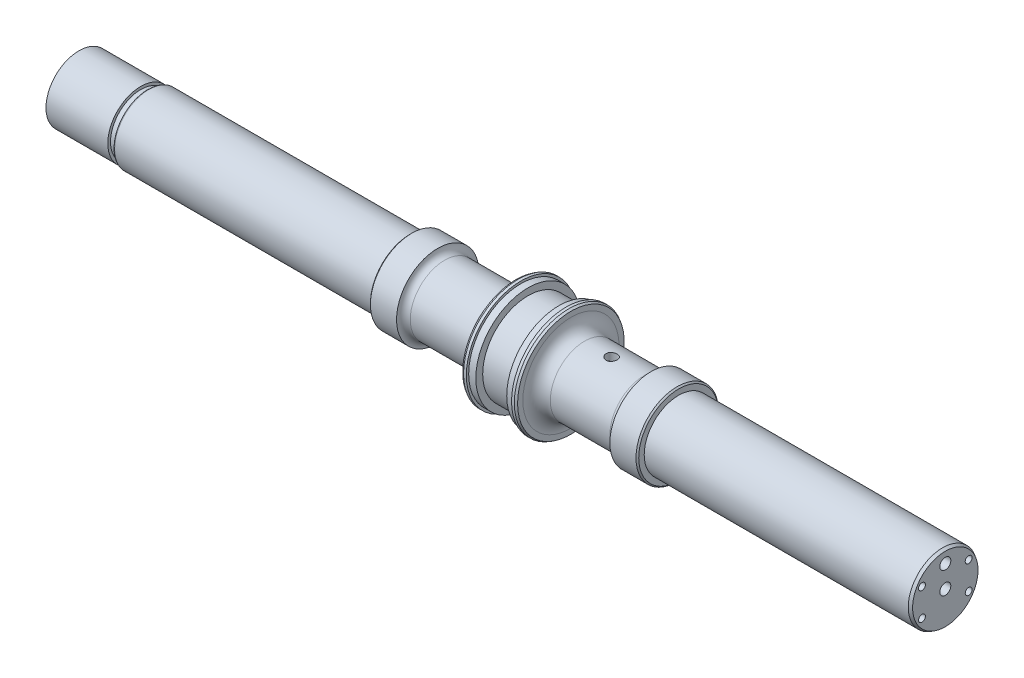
SolidWorks part; units mm, degrees
ref_plane "Plan de face" through (0, 0, 0) normal (0, 0, 1) x (1, 0, 0)
ref_plane "Plan de dessus" through (0, 0, 0) normal (0, 1, 0) x (1, 0, 0)
ref_plane "Plan de droite" through (0, 0, 0) normal (1, 0, 0) x (0, 0, -1)
sketch "Esquisse1" plane through (0, 0, 0) normal (0, 0, 1) x (1, 0, 0)
  line L0 (0, 0) -> (685.6091, 0) construction
  line L1 (0, 0) -> (0, 24)
  line L2 (0, 24) -> (45, 24)
  line L3 (45, 24) -> (45, 22)
  line L4 (45, 22) -> (50, 22)
  line L5 (50, 22) -> (50, 25)
  line L6 (50, 25) -> (241.3, 25)
  line L7 (241.3, 25) -> (241.3, 30)
  line L8 (241.3, 30) -> (261.3, 30)
  line L9 (261.3, 30) -> (261.3, 25)
  line L10 (261.3, 25) -> (318.3, 25)
  line L11 (318.3, 25) -> (318.3, 39.7)
  line L12 (318.3, 39.7) -> (321.85, 39.7)
  line L13 (321.85, 39.7) -> (321.85, 38)
  line L14 (321.85, 38) -> (327.05, 38)
  line L15 (327.05, 38) -> (327.05, 33)
  line L16 (327.05, 33) -> (349.55, 33)
  line L17 (349.55, 33) -> (349.55, 38)
  line L18 (349.55, 38) -> (354.75, 38)
  line L19 (354.75, 38) -> (354.75, 39.7)
  line L20 (354.75, 39.7) -> (358.3, 39.7)
  line L21 (358.3, 39.7) -> (358.3, 25)
  line L22 (358.3, 25) -> (416.7, 25)
  line L23 (416.7, 25) -> (416.7, 30)
  line L24 (416.7, 30) -> (436.7, 30)
  line L25 (436.7, 30) -> (436.7, 25)
  line L26 (436.7, 25) -> (631, 25)
  line L27 (631, 25) -> (631, 4)
  line L28 (0, 0) -> (293.5966, 0)
  line L29 (631, 4) -> (296, 4)
  line L30 (296, 4) -> (293.5966, 0)
  dimension "D1" = 48
  dimension "D2" = 45
  dimension "D3" = 44
  dimension "D4" = 50
  dimension "D5" = 50
  dimension "D6" = 241.3
  dimension "D7" = 60
  dimension "D8" = 20
  dimension "D9" = 50
  dimension "D10" = 318.3
  dimension "D11" = 66
  dimension "D12" = 79.4
  dimension "D13" = 5.2
  dimension "D14" = 8.75
  dimension "D15" = 76
  dimension "D16" = 40
  dimension "D17" = 79.4
  dimension "D18" = 22.5
  dimension "D19" = 76
  dimension "D20" = 3.55
  dimension "D21" = 50
  dimension "D22" = 60
  dimension "D23" = 416.7
  dimension "D24" = 20
  dimension "D25" = 50
  dimension "D26" = 631
  dimension "D27" = 59
  dimension "D28" = 335
  dimension "D29" = 8
revolve "Révolution1" add sketch "Esquisse1" angle 360 about L0
fillet "Congé1" radius 10 2 edges at (318.3, 0, 25) (358.3, 0, 25)
fillet "Congé2" radius 5 2 edges at (416.7, 0, 25) (261.3, 0, 25)
chamfer "Chanfrein1" distance 1 angle 45 2 edges at (436.7, 0, 30) (241.3, 0, 30)
fillet "Congé3" radius 1 1 edges at (50, 0, 25)
chamfer "Chanfrein3" distance 2 angle 30 1 edges at (631, 0, 25)
chamfer "Chanfrein4" distance 1.5 angle 30 2 edges at (358.3, 0, 39.7) (318.3, 0, 39.7)
sketch "Esquisse4" plane through (631, 0, 0) normal (1, 0, 0) x (0, 0, -1)
  line L0 (0, -15.7061) -> (0, 48.4912) construction
  point P3 (0, 16)
  dimension "D1" = 16
hole_wizard "Dégagement M81" positions "Esquisse3D1" profile "Esquisse6" hole size "M8" standard "ISO"
sketch3d "Esquisse3D1"
  point P0 (631, 16, 0)
sketch "Esquisse6" plane through (631, 16, 0) normal (0, 1, 0) x (0, 0, -1)
  line L0 (0, 0) -> (0, 253.4034)
  line L1 (0, 253.4034) -> (4, 251)
  line L2 (4, 251) -> (4, 0)
  line L5 (4, 0) -> (0, 0)
  line L10 (0, 253.4034) -> (-4, 251) construction
  line L11 (0, -6.35) -> (0, 107.95) construction
  dimension "Diamètre du perçage" = 8
  dimension "Profondeur du perçage" = 251
  dimension "Angle de pointe" = 118
sketch "Esquisse7" plane through (631, 0, 0) normal (1, 0, 0) x (0, 0, -1)
  line L0 (-20.0874, -10) -> (20.208, -10) construction
  line L1 (17, 15.1259) -> (17, -16.6794) construction
  line L2 (-17, -13.8575) -> (-17, 14.1253) construction
  line L3 (-20.7242, 10) -> (19.3617, 10) construction
  point P5 (17, -10)
  point P11 (-17, -10)
  point P12 (-17, 10)
  point P13 (17, 10)
  dimension "D1" = 10
  dimension "D2" = 17
  dimension "D3" = 20
  dimension "D4" = 34
hole_wizard "Trou taraudé M61" positions "Esquisse3D3" profile "Esquisse9" tap size "M6" standard "ISO"
sketch3d "Esquisse3D3"
  point P0 (631, 10, 17)
  point P3 (631, 10, -17)
  point P6 (631, -10, -17)
  point P9 (631, -10, 17)
sketch "Esquisse9" plane through (631, 10, 17) normal (0, 1, 0) x (0, 0, -1)
  line L0 (0, 0) -> (0, 21.5022)
  line L1 (0, 21.5022) -> (2.5, 20)
  line L2 (2.5, 20) -> (2.5, 0)
  line L5 (2.5, 0) -> (0, 0)
  line L10 (0, 21.5022) -> (-2.5, 20) construction
  line L11 (0, -6.35) -> (0, 107.95) construction
  dimension "Diamètre du trou pour taraudage" = 5
  dimension "Profondeur du trou pour taraudage" = 20
  dimension "Angle de pointe" = 118
ref_plane "Plan1" through (532.85, 25, 0) normal (0, 1, 0) x (0, 0, -1)
sketch "Esquisse10" plane through (532.85, 25, 0) normal (0, 1, 0) x (0, 0, -1)
  line L0 (0, -130.6576) -> (0, 164.55) construction
  line L1 (-25, 164.55) -> (25, 164.55) construction
  line L2 (-23.8453, -98.15) -> (23.8453, -98.15) construction
  circle A0 centre (0, 144.85) radius 4
  dimension "D1" = 8
  dimension "D2" = 243
extrude "Extrusion1" cut sketch "Esquisse10" against normal blind 9
ref_plane "Plan2" through (0, 0, 0) normal (0, 0, -1) x (-1, 0, 0)
ref_plane "Plan3" through (287.3, -25, 0) normal (0, -1, 0) x (0, 0, 1)
sketch "Esquisse11" plane through (287.3, -25, 0) normal (0, -1, 0) x (0, 0, 1)
  line L0 (0, -21) -> (0, 21) construction
  line L1 (-23.8453, -343.7) -> (23.8453, -343.7) construction
  circle A0 centre (0, -16.7) radius 4
  dimension "D1" = 8
  dimension "D2" = 327
extrude "Extrusion2" cut sketch "Esquisse11" against normal blind 25
